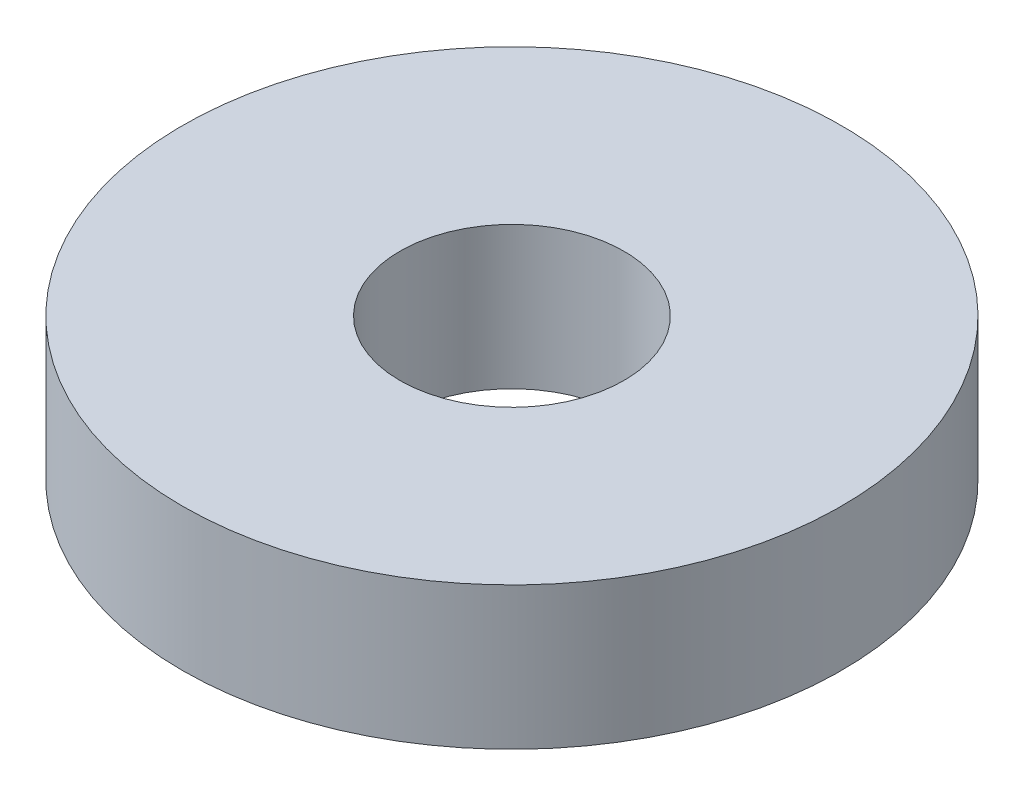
SolidWorks part; units mm, degrees
ref_plane "Front Plane" through (0, 0, 0) normal (0, 0, 1) x (1, 0, 0)
ref_plane "Top Plane" through (0, 0, 0) normal (0, 1, 0) x (1, 0, 0)
ref_plane "Right Plane" through (0, 0, 0) normal (1, 0, 0) x (0, 0, -1)
sketch "Sketch1" plane through (0, 0, 0) normal (0, 1, 0) x (1, 0, 0)
  circle A0 centre (0, 0) radius 2.159
  circle A1 centre (0, 0) radius 6.35
  dimension "D1" = 4.318
  dimension "D2" = 12.7
extrude "Boss-Extrude1" add sketch "Sketch1" along normal blind 2.7432
